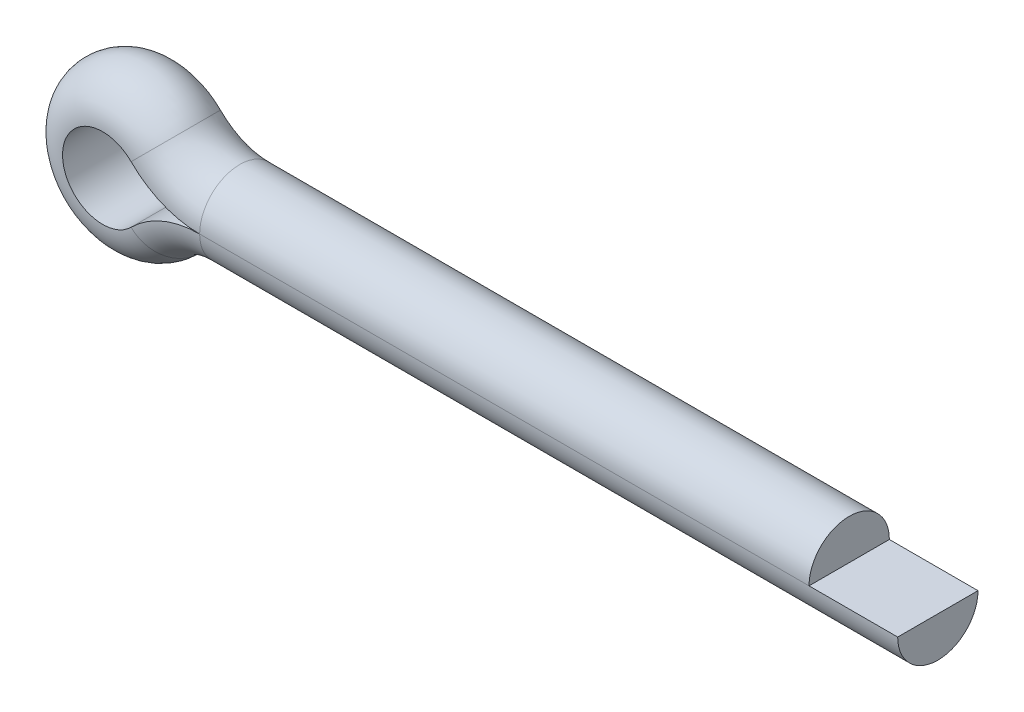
SolidWorks part; units mm, degrees
ref_plane "Front" through (0, 0, 0) normal (0, 0, 1) x (1, 0, 0)
ref_plane "Top" through (0, 0, 0) normal (0, 1, 0) x (1, 0, 0)
ref_plane "Right" through (0, 0, 0) normal (1, 0, 0) x (0, 0, -1)
ref_plane "Plane1" through (28.4, 0, 0) normal (1, 0, 0) x (0, 0, -1)
sketch "PathSke" plane through (1.208, 1.808, 0) normal (0, 0, 1) x (0, 1, 0)
  line L0 (-0.358, -27.192) -> (-0.358, -5.192)
  line L1 (-3.258, -5.192) -> (-3.258, -30.392)
  line L2 (-1.808, 1.208) -> (-1.808, -5.7761) construction
  arc A0 (-3.258, -5.192) -> (-3.8583, -3.7429) centre (-5.3071, -5.192) ccw
  arc A1 (-0.358, -5.192) -> (0.2424, -3.7429) centre (1.6912, -5.192) cw
  arc A3 (0.2424, -3.7429) -> (-3.8583, -3.7429) centre (-1.808, -1.692) ccw
  dimension "C" = 5.8
  dimension "d" = 2.9
  dimension "d/2" = 1.45
  dimension "l" = 22
  dimension "a" = 3.2
  dimension "b" = 6.4
sketch "SectionSke" plane through (28.4, 0.15, 0.15) normal (1, 0, 0) x (0, 1, 0)
  line L0 (-0.15, -1.6) -> (-0.15, 1.3)
  arc A0 (-0.15, -1.6) -> (-0.15, 1.3) centre (-0.15, -0.15) ccw
  dimension "R" = 1.45
  dimension "d1" = 2.9
sweep "Body" add profiles "SectionSke" path "PathSke"
equation "\"d/2@PathSke\" = \"d@PathSke\" / 2"
equation "\"R@SectionSke\" = \"d@PathSke\" / 2"
equation "\"d1@SectionSke\" = \"d@PathSke\""
equation "\"D1@Plane1\" = \"b@PathSke\" + \"l@PathSke\""
